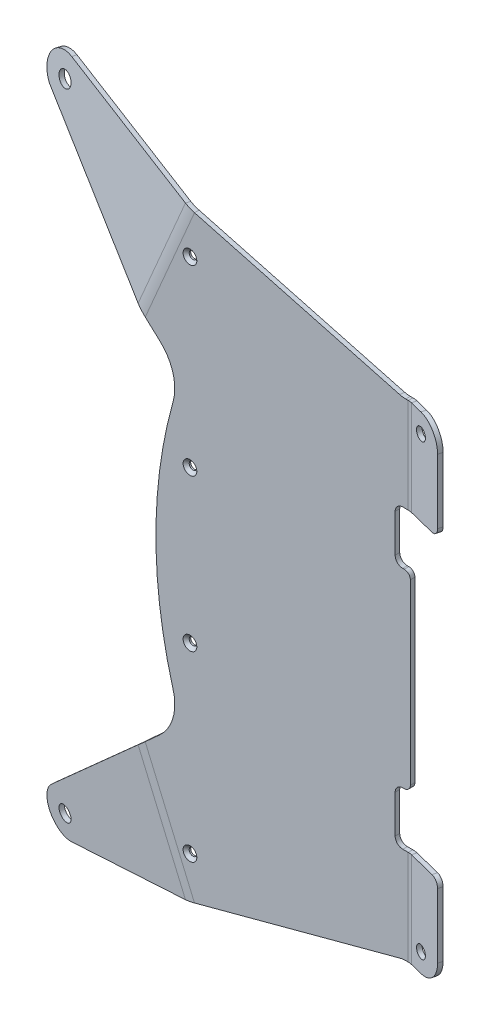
SolidWorks part; units mm, degrees
ref_plane "Plan1" through (0, 0, 0) normal (0, 0, 1) x (1, 0, 0)
ref_plane "Plan2" through (0, 0, 0) normal (0, 1, 0) x (1, 0, 0)
ref_plane "Plan3" through (0, 0, 0) normal (1, 0, 0) x (0, 0, -1)
sketch "Esquisse1" plane through (0, 0, 0) normal (0, 0, 1) x (1, 0, 0)
  line L0 (-189.8079, -112.1874) -> (-285.096, -198.9063)
  line L1 (-286.9011, 200.8696) -> (-189.768, 112.1509)
  line L2 (-25, 58.5) -> (-25, -58.5)
  line L3 (0, -145) -> (0, -102.5)
  line L4 (-5, 97.5) -> (-30, 97.5)
  line L6 (-30, 62.5) -> (-29, 62.5)
  line L7 (-35, 67.5) -> (-35, 92.5)
  line L8 (-29, -62.5) -> (-30, -62.5)
  line L9 (-15, 160) -> (-28.0287, 160)
  line L10 (-30, -97.5) -> (-5, -97.5)
  line L11 (-35, -92.5) -> (-35, -67.5)
  line L12 (0, 102.5) -> (0, 145)
  line L13 (-15, -160) -> (-28.0287, -160)
  line L14 (-271.1244, 224.4907) -> (-31.9044, 160.5093)
  line L15 (-271.1244, -224.4907) -> (-31.9044, -160.5093)
  arc A0 (-181.1205, 81.8776) -> (-181.1205, -81.8776) centre (110, 0) ccw
  arc A1 (-189.8079, -112.1874) -> (-181.1205, -81.8776) centre (-210, -90) ccw
  circle A2 centre (-15, 147.5) radius 4
  circle A3 centre (-15, -147.5) radius 4
  arc A4 (-5, 97.5) -> (0, 102.5) centre (-5, 102.5) ccw
  arc A5 (-35, 92.5) -> (-30, 97.5) centre (-30, 92.5) cw
  arc A6 (-35, 67.5) -> (-30, 62.5) centre (-30, 67.5) ccw
  arc A7 (-25, 58.5) -> (-29, 62.5) centre (-29, 58.5) ccw
  arc A8 (-25, -58.5) -> (-29, -62.5) centre (-29, -58.5) cw
  arc A9 (-35, -67.5) -> (-30, -62.5) centre (-30, -67.5) cw
  arc A10 (-30, -97.5) -> (-35, -92.5) centre (-30, -92.5) cw
  arc A11 (0, -102.5) -> (-5, -97.5) centre (-5, -102.5) ccw
  arc A12 (0, 145) -> (-15, 160) centre (-15, 145) ccw
  arc A13 (-15, -160) -> (0, -145) centre (-15, -145) ccw
  arc A14 (-28.0287, 160) -> (-31.9044, 160.5093) centre (-28.0287, 175) cw
  arc A15 (-31.9044, -160.5093) -> (-28.0287, -160) centre (-28.0287, -175) cw
  circle A16 centre (-275, 210) radius 5
  arc A17 (-285.096, -198.9063) -> (-271.1244, -224.4907) centre (-275, -210) ccw
  circle A18 centre (-275, -210) radius 5
  arc A19 (-181.1205, 81.8776) -> (-189.768, 112.1509) centre (-210, 90) ccw
  circle A20 centre (-170, 170) radius 2.5
  circle A21 centre (-170, 50) radius 2.5
  circle A22 centre (-170, -50) radius 2.5
  circle A23 centre (-170, -170) radius 2.5
  arc A24 (-271.1244, 224.4907) -> (-286.9011, 200.8696) centre (-275, 210) ccw
  point P22 (0, 97.5)
  point P25 (-35, 97.5)
  point P28 (-35, 62.5)
  point P29 (-25, 62.5)
  point P43 (-30, 160)
  point P52 (-30, -160)
  point P57 (-222.5084, 49.8312)
  dimension "D3" = 8
  dimension "D4" = 210
  dimension "D15" = 15
  dimension "D12" = 5
  dimension "D2" = 15
  dimension "D19" = 15
  dimension "D21" = 180
  dimension "D14" = 195
  dimension "D22" = 302.4154
  dimension "D23" = 90
  dimension "D25" = 30
  dimension "D6" = 60
  dimension "D27" = 10
  dimension "D28" = 120
  dimension "D29" = 5
  dimension "D18" = 4
  dimension "D33" = 10
  dimension "D1" = 420
  dimension "D5" = 260
  dimension "D7" = 295
  dimension "D8" = 147.5
  dimension "D9" = 15
  dimension "D10" = 62.5
  dimension "D11" = 35
  dimension "D13" = 125
  dimension "D16" = 320
  dimension "D17" = 160
  dimension "D20" = 30
  dimension "D24" = 120
  dimension "D26" = 210
  dimension "D30" = 50
  dimension "D31" = 50
  dimension "D32" = 35
extrude "Base-Extrusion" add sketch "Esquisse1" along normal blind 3
chamfer "Chanfrein1" distance 2 angle 45
sheet metal parameters "Tôlerie 1" parameters "D1"=10
flatten bends "Dépliage 1" parameters "D1"=0
sketch "Esquisse-Angle1" plane through (0, 0, 3) normal (0, 0, 1) x (1, 0, 0)
process bends "Pliage 1" parameters "D1"=0
sketch "Esquisse-Plate1" plane through (0, 0, 3) normal (0, 0, 1) x (1, 0, 0)
  line L0 (-25, 160) -> (-25, 97.5)
  line L1 (-202.0283, -123.3088) -> (-170.2351, -197.507)
  line L2 (-25, -97.5) -> (-25, -160)
  line L3 (-30, -97.5) -> (-5, -97.5) construction
  line L5 (0, 102.5) -> (0, 145) construction
  line L6 (0, 102.5) -> (0, 145) construction
  line L12 (-170.2351, 197.507) -> (-201.9984, 123.3219)
  line L13 (-271.1244, 224.4907) -> (-31.9044, 160.5093) construction
  line L14 (-286.9011, 200.8696) -> (-189.768, 112.1509) construction
  line L15 (-189.8079, -112.1874) -> (-285.096, -198.9063) construction
  line L16 (-271.1244, -224.4907) -> (-31.9044, -160.5093) construction
  point P2 (-37.5, -128.75)
  dimension "D1" = 25
  dimension "D2" = 150
  dimension "D3" = 80
  dimension "D4" = 80
  dimension "D5" = 150
bend "Pli défini à plat1" bend radius 10 bend angle 14 parameters "D5"=1
bend "Pli défini à plat2" bend radius 10 bend angle 14 parameters "D5"=2
bend "Pli défini à plat5" bend radius 30 bend angle 12 parameters "D5"=3
bend "Pli défini à plat6" bend radius 30 bend angle 12 parameters "D5"=4
